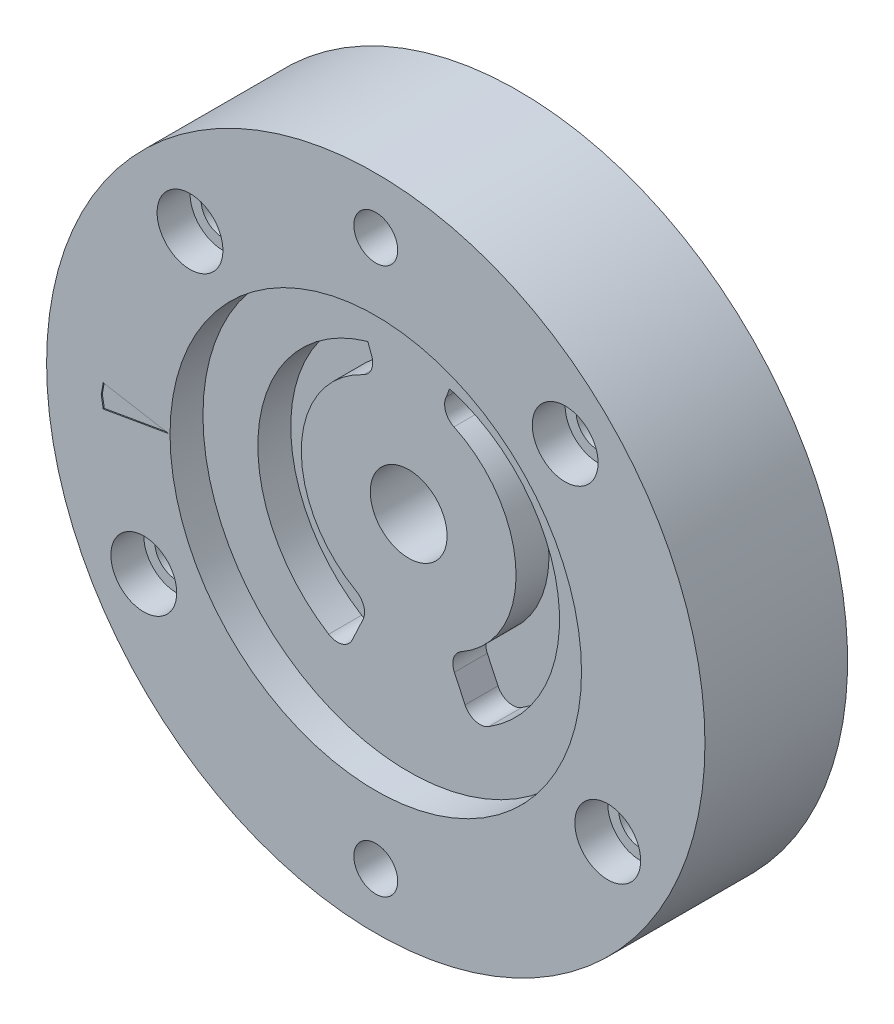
SolidWorks part; units mm, degrees
ref_plane "Plan1" through (0, 0, 0) normal (0, 0, 1) x (1, 0, 0)
ref_plane "Plan2" through (0, 0, 0) normal (0, 1, 0) x (1, 0, 0)
ref_plane "Plan3" through (0, 0, 0) normal (1, 0, 0) x (0, 0, -1)
sketch "Esquisse1" plane through (0, 0, 0) normal (0, 0, 1) x (1, 0, 0)
  circle A0 centre (0, 0) radius 18.75
  circle A1 centre (0, 0) radius 30
  dimension "D1" = 37.5
  dimension "D2" = 60
extrude "Base-Extrusion" add sketch "Esquisse1" along normal blind 3
sketch "Esquisse2" plane through (0, 0, 0) normal (0, 0, -1) x (-1, 0, 0)
  circle A0 centre (0, 0) radius 30 construction
  circle A2 centre (0, 0) radius 30
  circle A3 centre (0, 1.6) radius 3.5
  dimension "D3" = 7
  dimension "D4" = 1.6
extrude "Boss.-Extru.1" add sketch "Esquisse2" along normal blind 10
sketch "Esquisse3" plane through (0, 0, 3) normal (0, 0, 1) x (1, 0, 0)
  line L0 (0, 0) -> (-35.4734, 0) construction
  line L1 (-18.8716, 0) -> (-24.8379, 1.0376)
  line L2 (-18.8716, 0) -> (-24.8379, -1.0376)
  line L3 (-24.8379, 1.0376) -> (-25.0183, 0)
  line L4 (-24.8379, -1.0376) -> (-25.0183, 0)
extrude "Enlèv. mat.-Extru.1" cut sketch "Esquisse3" against normal blind 0.1
sketch "Esquisse4" plane through (0, 0, -10) normal (0, 0, -1) x (-1, 0, 0)
  line L0 (0, 0) -> (0, 31.9066) construction
  line L1 (-28.3398, 0) -> (25.7458, 0) construction
  line L2 (-17.2611, 17.2611) -> (0, 0) construction
  line L3 (-21.1404, -12.2054) -> (0, 0) construction
  line L4 (0, 0) -> (19.8862, 19.8862) construction
  line L5 (0, 0) -> (21.1404, -12.2054) construction
  circle A0 centre (0, 24.9027) radius 2
  circle A1 centre (-17.2611, 17.2611) radius 2
  circle A2 centre (16.9287, 16.9287) radius 2
  circle A3 centre (0, -24.9027) radius 2
  circle A4 centre (-21.1404, -12.2054) radius 2
  circle A5 centre (21.1404, -12.2054) radius 2
  dimension "D1" = 45
  dimension "D2" = 120
  dimension "D3" = 45
extrude "Enlèv. mat.-Extru.2" cut sketch "Esquisse4" against normal through all
sketch "Esquisse5" plane through (0, 0, 3) normal (0, 0, 1) x (1, 0, 0)
  circle A0 centre (-16.9287, 16.9287) radius 3
  circle A1 centre (17.2611, 17.2611) radius 3
  circle A2 centre (21.1404, -12.2054) radius 3
  circle A3 centre (-21.1404, -12.2054) radius 3
  dimension "D1" = 6
extrude "Enlèv. mat.-Extru.3" cut sketch "Esquisse5" against normal blind 3
sketch "Esquisse6" plane through (0, 0, 0) normal (0, 0, 1) x (1, 0, 0)
  line L0 (0, 19.9741) -> (0, -17.1206) construction
  line L1 (-3.44, 12.5668) -> (-3.7237, 13.3463)
  line L2 (4.1646, -8.8183) -> (5.137, -10.9035)
  line L3 (-4.1646, -8.8183) -> (-5.137, -10.9035)
  line L5 (-18.8716, 0) -> (17.4751, 0) construction
  line L6 (3.44, 12.5668) -> (3.7237, 13.3463)
  arc A0 (-5.137, -10.9035) -> (-7.2921, -11.5411) centre (-6.4964, -10.2695) cw
  arc A1 (-7.2921, -11.5411) -> (-3.7237, 13.3463) centre (0, 0.1128) cw
  arc A2 (-3.44, 12.5668) -> (-4.1238, 10.5318) centre (-4.7751, 11.8831) cw
  arc A3 (-4.1238, 10.5318) -> (-4.7899, -6.8763) centre (0, 1.6572) ccw
  arc A4 (4.1646, -8.8183) -> (4.7899, -6.8763) centre (5.5241, -8.1843) cw
  arc A5 (-4.1646, -8.8183) -> (-4.7899, -6.8763) centre (-5.5241, -8.1843) ccw
  arc A6 (5.137, -10.9035) -> (7.2921, -11.5411) centre (6.4964, -10.2695) ccw
  arc A10 (7.2921, -11.5411) -> (3.7237, 13.3463) centre (0, 0.1128) ccw
  arc A11 (3.44, 12.5668) -> (4.1238, 10.5318) centre (4.7751, 11.8831) ccw
  arc A12 (4.1238, 10.5318) -> (4.7899, -6.8763) centre (0, 1.6572) cw
  point P14 (-4.3774, -7.1637)
  point P15 (-4.9593, -16.7384)
  point P19 (-7.0865, -11.6672)
  point P22 (3.535, -7.4679)
  point P24 (2.9336, -11.1729)
  point P26 (5.9635, 12.2737)
  point P27 (4.9593, -16.7384)
  dimension "D1" = 25
extrude "Enlèv. mat.-Extru.4" cut sketch "Esquisse6" against normal blind 3
